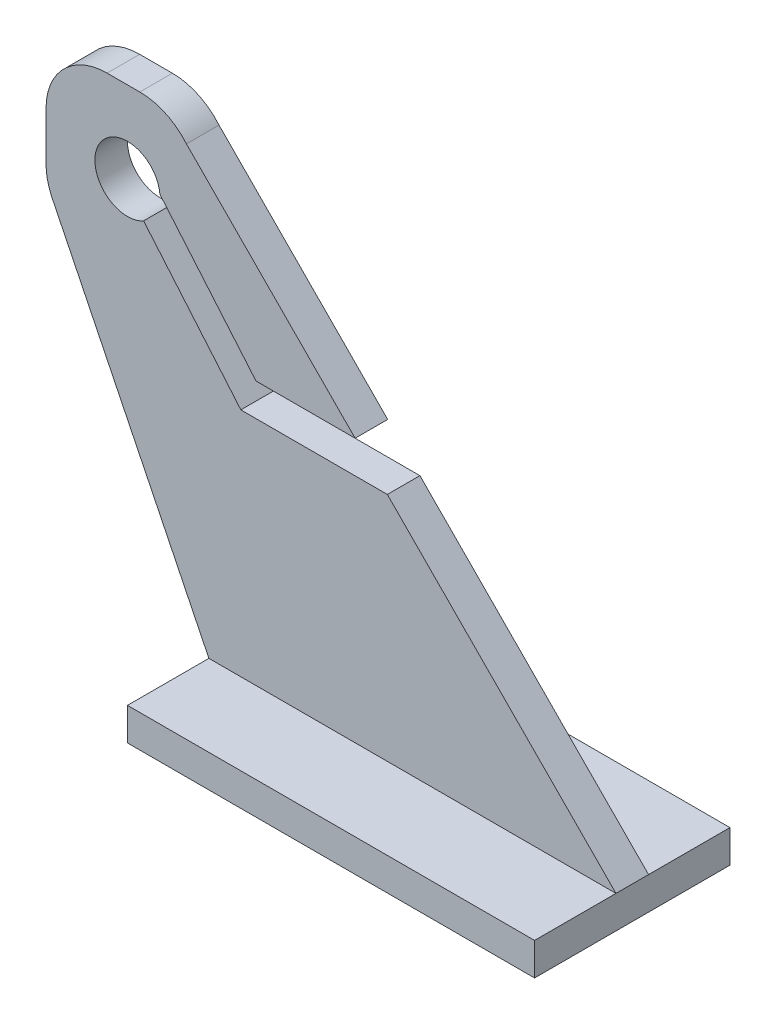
SolidWorks part; units mm, degrees
ref_plane "Front Plane" through (0, 0, 0) normal (0, 0, 1) x (1, 0, 0)
ref_plane "Top Plane" through (0, 0, 0) normal (0, 1, 0) x (1, 0, 0)
ref_plane "Right Plane" through (0, 0, 0) normal (1, 0, 0) x (0, 0, -1)
sketch "Sketch1" plane through (0, 0, 0) normal (0, 0, 1) x (1, 0, 0)
  line L0 (1, 9.3196) -> (1, 10.5)
  line L1 (2.5, 12) -> (3.3037, 12)
  line L2 (5, 0) -> (15, 0)
  line L3 (4.4494, 11.4682) -> (15, 0.8)
  line L4 (15, 0.8) -> (15, 0)
  line L9 (5, 0) -> (5, 0.8)
  line L10 (5, 0.8) -> (1.1303, 8.7081)
  arc A0 (1.1303, 8.7081) -> (1, 9.3196) centre (2.5, 9.3196) cw
  arc A1 (1, 10.5) -> (2.5, 12) centre (2.5, 10.5) cw
  arc A2 (4.4494, 11.4682) -> (3.3037, 12) centre (3.3037, 10.5) ccw
  circle A3 centre (3, 10) radius 0.8
  point P12 (1.3619, 8.7081)
  point P17 (4.4494, 11.3073)
  point P18 (1, 8.7081)
  dimension "D1" = 1.5
extrude "Boss-Extrude1" add sketch "Sketch1" along normal blind 0.8
sketch "Sketch2" plane through (0, 0, 0) normal (0, 0, 1) x (1, 0, 0)
  line L1 (5, 0) -> (15, 0)
  line L2 (5, 0) -> (5, 0.8)
  line L3 (5, 0.8) -> (15, 0.8)
  line L4 (15, 0) -> (15, 0.8)
extrude "Boss-Extrude2" add sketch "Sketch2" along normal blind 2.8 and the other way blind 2
sketch "Sketch3" plane through (0, 0, 0.8) normal (0, 0, 1) x (1, 0, 0)
  line L0 (3.0567, 9.7076) -> (5.7853, 6.4788)
  line L1 (3.6678, 10.224) -> (6.1567, 7.2788)
  line L2 (5.7853, 6.4788) -> (10.116, 6.4788)
  line L3 (6.1567, 7.2788) -> (10.116, 7.2788)
  line L4 (3.6678, 10.224) -> (3.0567, 9.7076)
  line L5 (10.116, 7.2788) -> (10.116, 6.4788)
extrude "Cut-Extrude1" cut sketch "Sketch3" against normal blind 2.8
